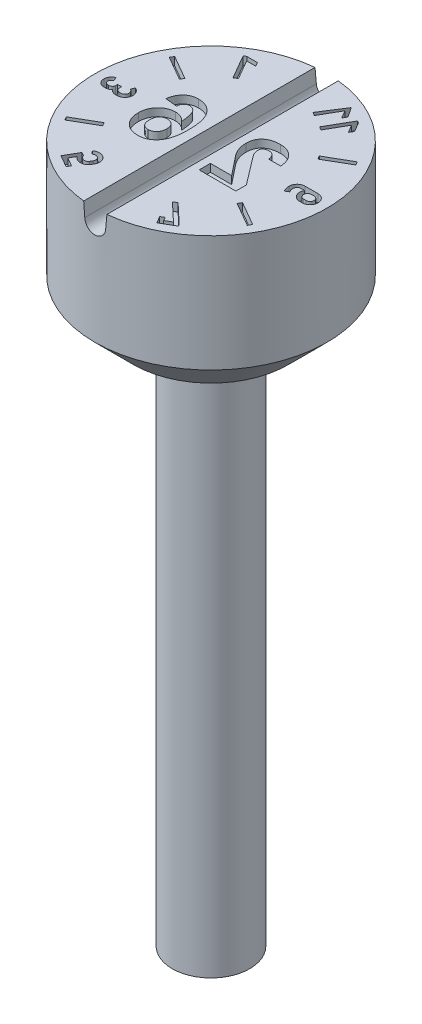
SolidWorks part; units mm, degrees
ref_plane "Front Plane" through (0, 0, 0) normal (0, 0, 1) x (1, 0, 0)
ref_plane "Top Plane" through (0, 0, 0) normal (0, 1, 0) x (1, 0, 0)
ref_plane "Right Plane" through (0, 0, 0) normal (1, 0, 0) x (0, 0, -1)
imported_body "Imported1"
sketch "Sketch1" plane through (0, -0.1, 0) normal (0, 1, 0) x (1, 0, 0)
  line L2 (-0.2515, -0.181) -> (-0.2515, 0.1827)
  line L3 (-0.7302, 0.1827) -> (-0.7302, -0.181)
  line L4 (-0.2515, -0.181) -> (-0.2515, 0.1827)
  line L5 (-0.7302, 0.1827) -> (-0.7302, -0.181)
  spline S4 degree 3 poles (1149.3423, 2770.4808) (-75.259, -19.3011) (0.5183, -3.6334) (-0.2597, 0.2566) (-0.2664, 0.2785) (-0.275, 0.2988) (-0.2857, 0.3176) (-0.2982, 0.3349) (-0.3126, 0.3506) (-0.3287, 0.3647) (-0.3469, 0.3768) (-0.3667, 0.3871) (-0.3882, 0.3956) (-0.4114, 0.4021) (-3.7982, 1.0142) (-14.2431, -50.136) (1463.224, 2618.8695) knots -31.351127 -31.351127 -31.351127 -31.351127 0.136229 0.199072 0.25942 0.317893 0.375172 0.431376 0.487845 0.544707 0.602193 0.661345 0.722459 0.786428 0.853446 28.151462 28.151462 28.151462 28.151462 only from (-0.2515, 0.1827) to (-0.4908, 0.4099)
  spline S5 degree 3 poles (-1510.1769, 2592.7872) (13.5914, -51.7487) (2.908, 1.0247) (-0.5705, 0.4021) (-0.5938, 0.3956) (-0.6152, 0.3871) (-0.6351, 0.377) (-0.6531, 0.3649) (-0.6693, 0.3507) (-0.6837, 0.3351) (-0.6961, 0.3178) (-0.7069, 0.2991) (-0.7153, 0.2787) (-0.7219, 0.2568) (-1.2023, -1.9819) (31.9025, -9.4238) (-2856.2766, 919.4719) knots -27.868135 -27.868135 -27.868135 -27.868135 0.146896 0.214298 0.278228 0.339305 0.397836 0.455287 0.512114 0.568549 0.624718 0.681585 0.739853 0.800578 0.863471 18.967229 18.967229 18.967229 18.967229 only from (-0.4908, 0.4099) to (-0.7302, 0.1827)
  spline S6 degree 3 poles (-278.1287, -2986.3987) (78.7429, 20.328) (-1.5271, 3.7754) (-0.722, -0.2549) (-0.7153, -0.2767) (-0.7066, -0.297) (-0.696, -0.3159) (-0.6834, -0.3332) (-0.6689, -0.349) (-0.6528, -0.3631) (-0.6347, -0.3752) (-0.6149, -0.3855) (-0.5933, -0.3937) (-0.5702, -0.4006) (4.1494, -1.2207) (19.7233, 87.5457) (-2516.6025, -1632.923) knots -32.499024 -32.499024 -32.499024 -32.499024 0.135837 0.198699 0.259064 0.317554 0.374849 0.431675 0.488161 0.545039 0.602541 0.661711 0.722684 0.786373 0.853837 38.888742 38.888742 38.888742 38.888742 only from (-0.7302, -0.181) to (-0.4908, -0.4083)
  spline S7 degree 3 poles (1043.7275, -2812.764) (-11.7013, 39.304) (-3.2805, -0.9365) (-0.4036, -0.3989) (-0.3735, -0.3888) (-0.3465, -0.3749) (-0.3284, -0.3626) (-0.3122, -0.3483) (-0.2978, -0.3325) (-0.2854, -0.3151) (-0.2748, -0.2963) (-0.2664, -0.276) (-0.2597, -0.2543) (0.2425, 2.1127) (-35.3089, 9.9981) (2828.3844, -999.2905) knots -22.993067 -22.993067 -22.993067 -22.993067 0.147075 0.214639 0.339917 0.399105 0.456869 0.514052 0.570876 0.627466 0.684188 0.742528 0.802498 0.865468 20.026276 20.026276 20.026276 20.026276 only from (-0.4908, -0.4083) to (-0.2515, -0.181)
  spline S8 degree 3 poles (-0.2515, 0.1827) (-0.2515, 0.1998) (-0.2533, 0.2247) (-0.2597, 0.2566) (-0.2664, 0.2785) (-0.275, 0.2988) (-0.2857, 0.3176) (-0.2982, 0.3349) (-0.3126, 0.3506) (-0.3287, 0.3647) (-0.3469, 0.3768) (-0.3667, 0.3871) (-0.3882, 0.3956) (-0.4114, 0.4021) (-0.4457, 0.4083) (-0.4725, 0.4099) (-0.4908, 0.4099) knots 0 0 0 0 0.136229 0.199072 0.25942 0.317893 0.375172 0.431376 0.487845 0.544707 0.602193 0.661345 0.722459 0.786428 0.853446 1 1 1 1
  spline S9 degree 3 poles (-0.4908, 0.4099) (-0.5093, 0.4099) (-0.5362, 0.4083) (-0.5705, 0.4021) (-0.5938, 0.3956) (-0.6152, 0.3871) (-0.6351, 0.377) (-0.6531, 0.3649) (-0.6693, 0.3507) (-0.6837, 0.3351) (-0.6961, 0.3178) (-0.7069, 0.2991) (-0.7153, 0.2787) (-0.7219, 0.2568) (-0.7288, 0.2249) (-0.73, 0.1998) (-0.7302, 0.1827) knots 0 0 0 0 0.146896 0.214298 0.278228 0.339305 0.397836 0.455287 0.512114 0.568549 0.624718 0.681585 0.739853 0.800578 0.863471 1 1 1 1
  spline S10 degree 3 poles (-0.7302, -0.181) (-0.7302, -0.1981) (-0.7283, -0.223) (-0.722, -0.2549) (-0.7153, -0.2767) (-0.7066, -0.297) (-0.696, -0.3159) (-0.6834, -0.3332) (-0.6689, -0.349) (-0.6528, -0.3631) (-0.6347, -0.3752) (-0.6149, -0.3855) (-0.5933, -0.3937) (-0.5702, -0.4006) (-0.5359, -0.4065) (-0.5092, -0.4083) (-0.4908, -0.4083) knots 0 0 0 0 0.135837 0.198699 0.259064 0.317554 0.374849 0.431675 0.488161 0.545039 0.602541 0.661711 0.722684 0.786373 0.853837 1 1 1 1
  spline S11 degree 3 poles (-0.4908, -0.4083) (-0.4724, -0.4082) (-0.4455, -0.4067) (-0.4036, -0.3989) (-0.3735, -0.3888) (-0.3465, -0.3749) (-0.3284, -0.3626) (-0.3122, -0.3483) (-0.2978, -0.3325) (-0.2854, -0.3151) (-0.2748, -0.2963) (-0.2664, -0.276) (-0.2597, -0.2543) (-0.253, -0.2227) (-0.2517, -0.1979) (-0.2515, -0.181) knots 0 0 0 0 0.147075 0.214639 0.339917 0.399105 0.456869 0.514052 0.570876 0.627466 0.684188 0.742528 0.802498 0.865468 1 1 1 1
  dimension "D1" = 0
extrude "Boss-Extrude1" add sketch "Sketch1" along normal up to vertex
sketch "Sketch2" plane through (0, 0, 0) normal (0, 1, 0) x (1, 0, 0)
  line L0 (0.2474, -0.4) -> (0.7205, -0.4) construction
  text T0 "6" font "Arial" height 0.7874
extrude "Cut-Extrude1" cut sketch "Sketch2" against normal up to surface (0.1 mm away)
